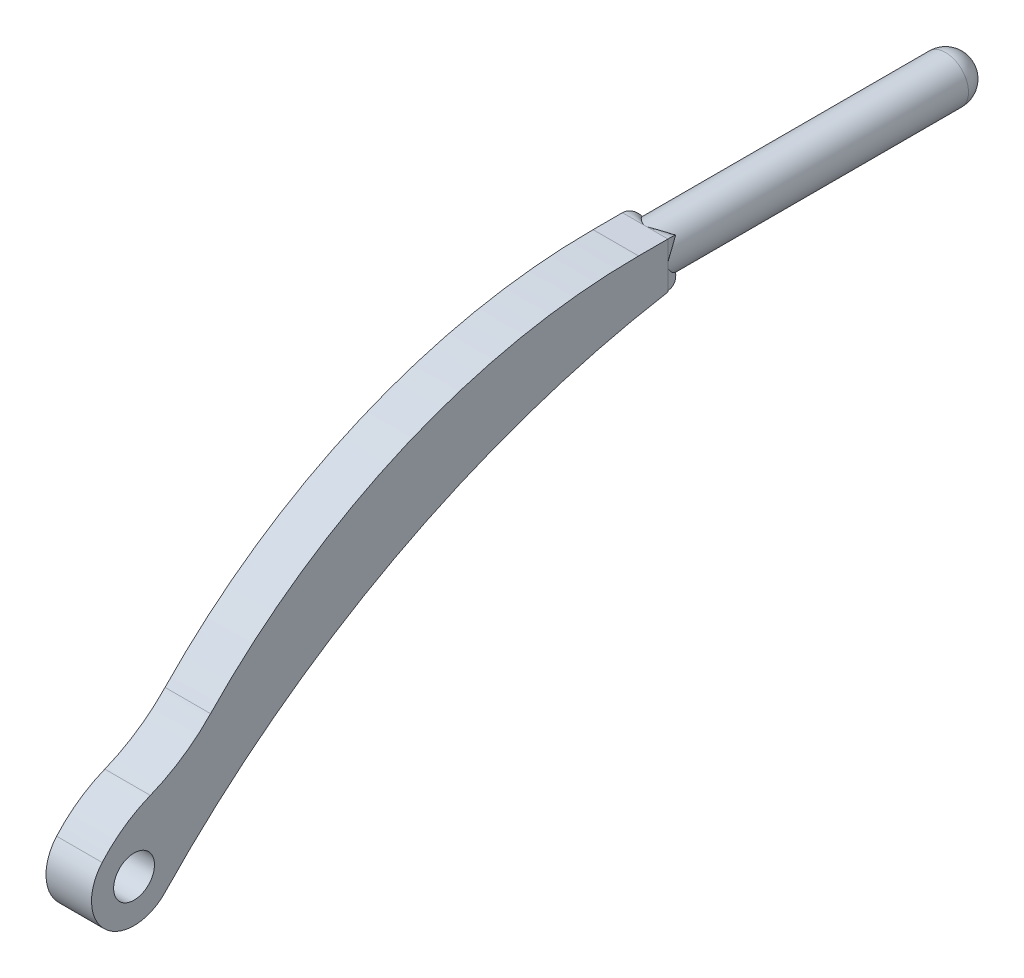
SolidWorks part; units mm, degrees
ref_plane "Front Plane" through (0, 0, 0) normal (0, 0, 1) x (1, 0, 0)
ref_plane "Top Plane" through (0, 0, 0) normal (0, 1, 0) x (1, 0, 0)
ref_plane "Right Plane" through (0, 0, 0) normal (1, 0, 0) x (0, 0, -1)
sketch "Sketch1" plane through (0, 0, 0) normal (1, 0, 0) x (0, 0, -1)
  line L0 (0, 0) -> (56.5153, 0) construction
  line L1 (56.5153, 0) -> (56.5153, 15.6972) construction
  line L2 (56.5153, 15.6972) -> (51.181, 15.6972) construction
  line L3 (51.181, 18.8144) -> (51.181, 12.6535) construction
  line L4 (51.181, 15.6972) -> (30.7709, 15.6972) construction
  line L5 (30.1244, 17.0287) -> (38.3232, 17.0287) construction
  line L6 (30.1244, 14.3109) -> (31.877, 14.3109) construction
  line L7 (31.877, 17.0287) -> (31.877, 14.2875) construction
  line L8 (30.1244, 14.3109) -> (38.3232, 14.3109) construction
  line L9 (31.877, 18.8144) -> (31.877, 12.6535) construction
  line L10 (30.1244, 17.0287) -> (31.877, 17.0287)
  line L11 (31.877, 17.0287) -> (31.877, 14.2875)
  circle A0 centre (0, 0) radius 1.2192
  arc A1 (-1.905, 1.6801) -> (1.8396, -1.7514) centre (0, 0) ccw
  arc A2 (0.9714, 3.7114) -> (-1.905, 1.6801) centre (3.81, -3.3601) ccw
  arc A3 (0.9714, 3.7114) -> (4.5678, 6.1386) centre (-2.8702, 13.2816) ccw
  arc A5 (30.1244, 17.0287) -> (4.5678, 6.1386) centre (30.1244, -18.4043) ccw
  arc A6 (31.877, 14.2875) -> (1.8396, -1.7514) centre (41.0972, -39.1262) ccw
  point P15 (35.3006, 16.6485)
  dimension "D3" = 5.08
  dimension "D4" = 2.4384
  dimension "D5" = 15.24
  dimension "D7" = 20.6248
  dimension "D9" = 19.304
  dimension "D13" = 108.4072
  dimension "D2" = 51.181
  dimension "D6" = 3.81
  dimension "D8" = 2.8702
  dimension "D10" = 30.1244
  dimension "D11" = 15.6972
  dimension "D14" = 41.0972
  dimension "D12" = 2.7178
extrude "Boss-Extrude1" add sketch "Sketch1" along normal mid plane 2.7178
sketch "Sketch2" plane through (0, 0, -31.877) normal (0, 0, -1) x (-1, 0, 0)
  line L0 (0, 0) -> (0, 20.5609) construction
  line L1 (-2.7347, 15.6581) -> (5.4525, 15.6581) construction
  line L2 (1.3589, 14.2875) -> (1.3589, 17.0287) construction
  circle A0 centre (0, 15.6581) radius 1.3589
  point P7 (1.3589, 15.6581)
  dimension "D1" = 2.7178
sketch "Sketch3" plane through (0, 0, 0) normal (1, 0, 0) x (0, 0, -1)
  line L0 (31.877, 15.6581) -> (51.181, 15.6581) construction
  line L1 (31.877, 14.2992) -> (31.877, 17.017) construction
  line L2 (51.181, 17.7747) -> (51.181, 13.8422) construction
  line L3 (49.8094, 17.0297) -> (49.8094, 14.2865)
  arc A0 (49.8094, 14.2865) -> (49.8094, 17.0297) centre (49.8094, 15.6581) ccw
  dimension "D2" = 2.7432
  dimension "D1" = 19.304
revolve "Revolve1" add sketch "Sketch3" angle 180 about L3
sketch "Sketch4" plane through (0, 0, -49.8094) normal (0, 0, 1) x (1, 0, 0)
  circle A1 centre (0, 15.6581) radius 1.3716
  circle A2 centre (0, 15.6581) radius 1.3716
  dimension "D1" = 0
extrude "Boss-Extrude3" add sketch "Sketch4" along normal up to surface (17.9324 mm away)
sketch "Sketch5" plane through (0, 0, -31.877) normal (0, 0, -1) x (-1, 0, 0)
  line L0 (-1.3589, 15.8443) -> (-0.0528, 17.0287)
  line L2 (-1.3589, 17.0287) -> (-1.3589, 15.8443)
  line L3 (-0.0528, 17.0287) -> (-1.3589, 17.0287)
  line L4 (-1.3589, 17.0287) -> (-1.3589, 15.8443)
  line L5 (-0.0528, 17.0287) -> (-1.3589, 17.0287)
  arc A1 (-0.0528, 17.0287) -> (-1.3589, 15.8443) centre (0, 15.6581) ccw
  dimension "D1" = 0
sketch3d "3DSketch1"
  line L0 (1.3589, 15.8443, -31.877) -> (0.0528, 17.0287, -31.877) construction
  line L1 (0.7058, 16.4365, -31.877) -> (0.7058, 16.4365, -32.2995) construction
ref_plane "Plane1" through (8.4976, 9.371, 0) normal (0.6717, 0.7408, 0) x (-0.7408, 0.6717, 0)
sketch "Sketch8" plane through (8.4976, 9.371, 0) normal (0.6717, 0.7408, 0) x (-0.7408, 0.6717, 0)
  line L0 (-0.6531, 0.5922) -> (-0.6531, -0.5922)
  line L1 (0.6531, 0.5922) -> (-0.6531, 0.5922)
  line L2 (6.8374, -26.8415) -> (6.8374, -28.0258)
  line L3 (8.1435, -26.8415) -> (6.8374, -26.8415)
  line L4 (10.6041, -32.7544) -> (11.3997, -31.877)
  line L5 (9.6366, -31.877) -> (10.6041, -32.7544)
  arc A0 (0.6531, 0.5922) -> (-0.6531, -0.5922) centre (0.7058, -0.7784) ccw
  arc A1 (8.1435, -26.8415) -> (6.8374, -28.0258) centre (8.1963, -28.2121) ccw
  arc A2 (9.6366, -31.877) -> (11.3997, -31.877) centre (10.5181, -30.8262) ccw
  point P12 (7.9733, -32.8734)
  dimension "D2" = 1.3716
  dimension "D1" = 90
  dimension "D3" = 1.1844
revolve "Revolve2" add sketch "Sketch5" angle 85 about L0
mirror "Mirror1" about plane through (0, 0, 0) normal (1, 0, 0) of "Revolve2"
ref_plane "Plane2" through (0, 15.6972, 0) normal (0, 1, 0) x (-1, 0, 0)
mirror "Mirror2" about plane through (0, 15.6972, 0) normal (0, 1, 0) of "Mirror1", "Revolve2"
